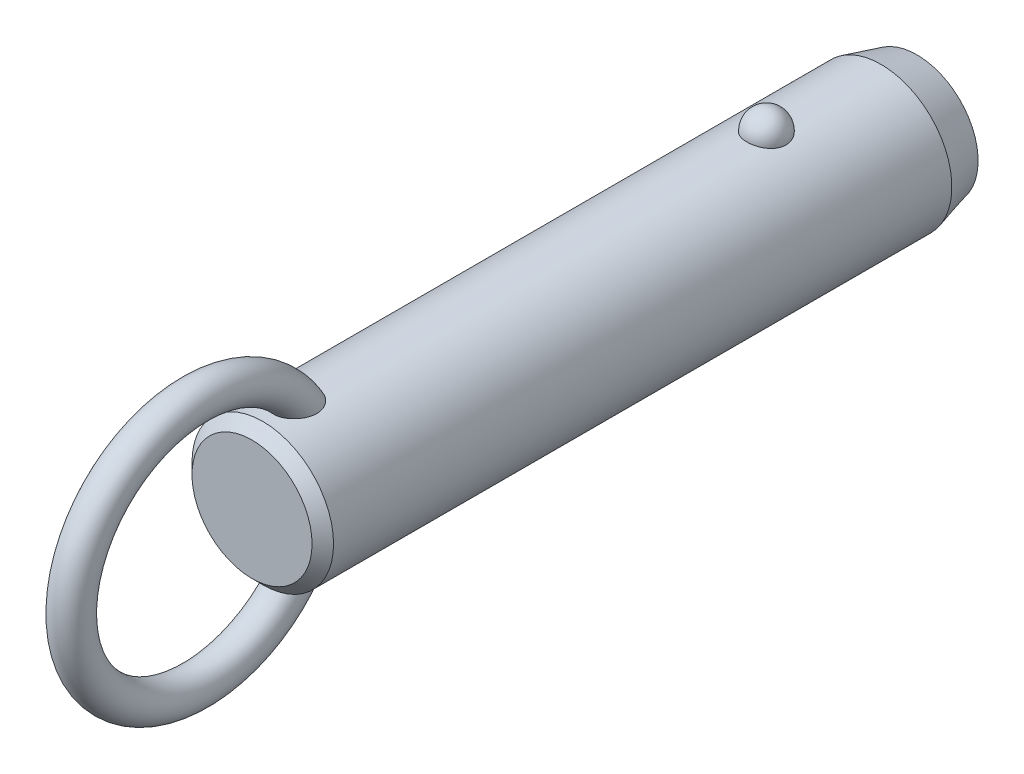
SolidWorks part; units mm, degrees
ref_plane "Front Plane" through (0, 0, 0) normal (0, 0, 1) x (1, 0, 0)
ref_plane "Top Plane" through (0, 0, 0) normal (0, 1, 0) x (1, 0, 0)
ref_plane "Right Plane" through (0, 0, 0) normal (1, 0, 0) x (0, 0, -1)
sketch "Sketch2" plane through (0, 0, 0) normal (0, 0, 1) x (1, 0, 0)
  circle A0 centre (0, 0) radius 7.9
  point P3 (0, 7.9)
  dimension "D1" = 15.8
extrude "Boss-Extrude1" add sketch "Sketch2" along normal blind 45.7
sketch "Sketch3" plane through (0, 0, 0) normal (0, 0, -1) x (-1, 0, 0)
  circle A0 centre (0, 0) radius 7.9
  dimension "D1" = 15.8
extrude "Boss-Extrude2" add sketch "Sketch3" along normal blind 19
chamfer "Chamfer1" distance 4 angle 15 1 edges at (-7.9, 0, -19)
sketch "Sketch12" plane through (0, 0, 0) normal (1, 0, 0) x (0, 0, -1)
  line L0 (-45.7, 7.9) -> (-45.7, -7.9) construction
  point P0 (-45.7, 0)
sketch "Sketch13" plane through (0, 0, 0) normal (1, 0, 0) x (0, 0, -1)
  circle A0 centre (-61.55, 0) radius 15.85
  point P2 (-45.7, 0)
  dimension "D1" = 31.7
sketch "Sketch14" plane through (0, 0, 0) normal (0, 1, 0) x (1, 0, 0)
  circle A0 centre (0, -47.7) radius 2
  point P2 (0, -45.7)
  dimension "D1" = 4
sweep "Sweep1" add profiles "Sketch14" path "Sketch13"
sketch "Sketch15" plane through (0, 0, 45.7) normal (0, 0, 1) x (1, 0, 0)
  circle A0 centre (0, 0) radius 7.9
  dimension "D1" = 15.8
extrude "Boss-Extrude3" add sketch "Sketch15" along normal blind 9.52
chamfer "Chamfer2" distance 1.2 angle 45 1 edges at (7.9, 0, 55.22)
sketch "Sketch18" plane through (0, 0, 0) normal (1, 0, 0) x (0, 0, -1)
  line L0 (15, 7.9) -> (-47.8091, 7.9) construction
  line L1 (2.2, 10.1) -> (2.2, 5.7)
  line L2 (-47.8091, -7.9) -> (15, -7.9) construction
  arc A0 (2.2, 10.1) -> (2.2, 5.7) centre (2.2, 7.9) ccw
  point P4 (0, 7.9)
  dimension "D1" = 18
revolve "Revolve1" add sketch "Sketch18" angle 360 about L1
